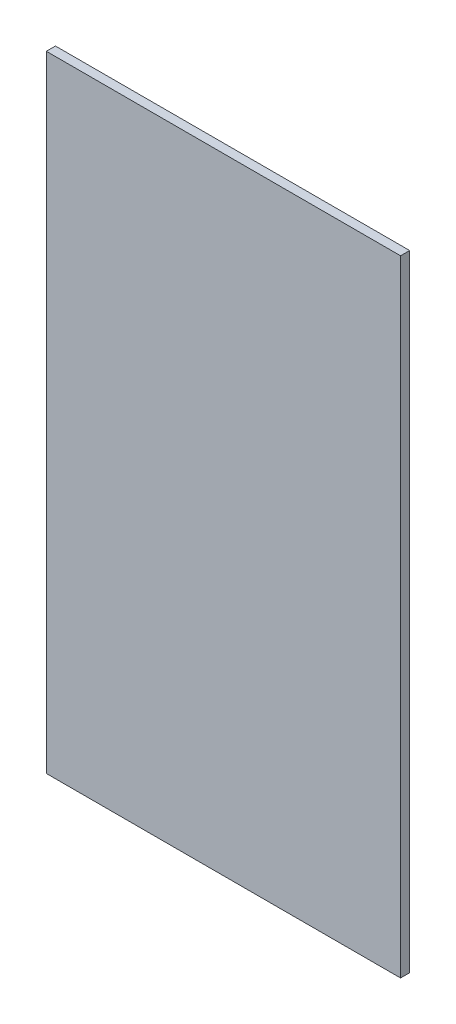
SolidWorks part; units mm, degrees
ref_plane "Front Plane" through (0, 0, 0) normal (0, 0, 1) x (1, 0, 0)
ref_plane "Top Plane" through (0, 0, 0) normal (0, 1, 0) x (1, 0, 0)
ref_plane "Right Plane" through (0, 0, 0) normal (1, 0, 0) x (0, 0, -1)
sketch "Sketch1" plane through (0, 0, 0) normal (0, 0, 1) x (1, 0, 0)
  line L1 (-350, 618) -> (350, 618)
  line L2 (-350, 618) -> (-350, -618)
  line L3 (-350, -618) -> (350, -618)
  line L4 (350, 618) -> (350, -618)
  line L5 (-350, 618) -> (350, -618) construction
  line L6 (-350, -618) -> (350, 618) construction
  point P0 (0, 0)
  dimension "D1" = 700
  dimension "D2" = 1236
extrude "Boss-Extrude1" add sketch "Sketch1" along normal blind 18
